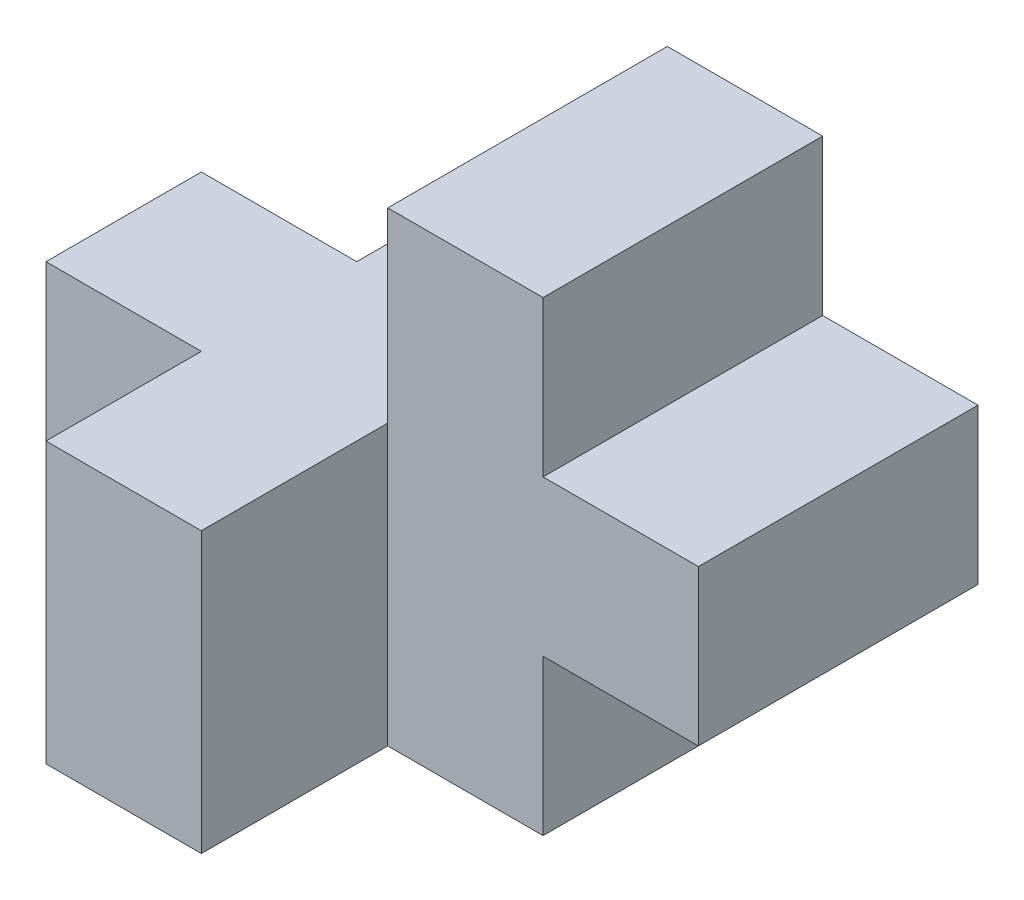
SolidWorks part; units mm, degrees
ref_plane "前视基准面" through (0, 0, 0) normal (0, 0, 1) x (1, 0, 0)
ref_plane "上视基准面" through (0, 0, 0) normal (0, 1, 0) x (1, 0, 0)
ref_plane "右视基准面" through (0, 0, 0) normal (1, 0, 0) x (0, 0, -1)
sketch "草图1" plane through (0, 0, 0) normal (0, 0, 1) x (1, 0, 0)
  line L0 (0, 0) -> (0, 75)
  line L1 (0, 75) -> (50, 75)
  line L2 (50, 75) -> (50, 25)
  line L3 (50, 25) -> (100, 25)
  line L4 (100, 25) -> (100, -25)
  line L5 (100, -25) -> (50, -25)
  line L6 (50, -25) -> (50, -75)
  line L7 (50, -75) -> (0, -75)
  line L8 (0, -75) -> (0, 0)
  dimension "D1" = 75
  dimension "D2" = 75
  dimension "D3" = 50
  dimension "D4" = 50
  dimension "D5" = 50
  dimension "D6" = 50
  dimension "D7" = 50
extrude "拉伸1" add sketch "草图1" against normal blind 90
sketch "草图2" plane through (0, -75, 0) normal (0, -1, 0) x (1, 0, 0)
  line L0 (0, -90) -> (-50, -90)
  line L1 (-50, -90) -> (-50, -40)
  line L2 (-50, -40) -> (-100, -40)
  line L3 (-100, -40) -> (-100, 10)
  line L4 (-100, 10) -> (-50, 10)
  line L5 (-50, 10) -> (-50, 60)
  line L6 (-50, 60) -> (0, 60)
  line L7 (0, 60) -> (0, -90)
  dimension "D1" = 50
  dimension "D2" = 50
  dimension "D3" = 50
  dimension "D4" = 50
  dimension "D5" = 50
  dimension "D6" = 50
extrude "拉伸2" add sketch "草图2" against normal blind 90
